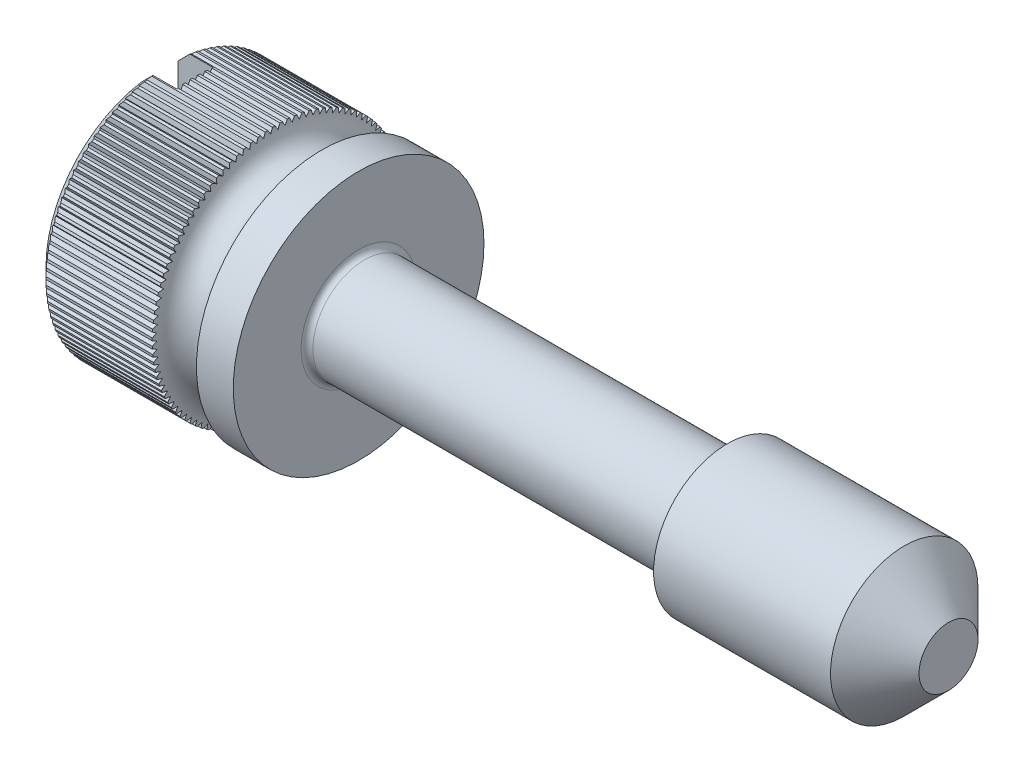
SolidWorks part; units mm, degrees
ref_plane "Front" through (0, 0, 0) normal (0, 0, 1) x (1, 0, 0)
ref_plane "Top" through (0, 0, 0) normal (0, 1, 0) x (1, 0, 0)
ref_plane "Right" through (0, 0, 0) normal (1, 0, 0) x (0, 0, -1)
sketch "Sketch1" plane through (0, 0, 0) normal (1, 0, 0) x (0, 0, -1)
  circle A0 centre (0, 0) radius 8.5
  dimension "dk" = 17
extrude "BaseHead" add sketch "Sketch1" along normal blind 13.5
sketch "Sketch2" plane through (12.6635, 0, 1.1635) normal (0, 1, 0) x (0, 0, 1)
  line L0 (7.3365, -1.6635) -> (10.3365, -1.6635)
  line L1 (7.3365, -4.6635) -> (10.3365, -4.6635)
  line L2 (10.3365, -4.6635) -> (10.3365, -1.6635)
  line L3 (7.3365, -12.6635) -> (7.3365, 0.8365) construction
  line L4 (7.3365, 0.8365) -> (-9.6635, 0.8365) construction
  line L5 (-1.1635, 4.9919) -> (-1.1635, -18.8189) construction
  arc A0 (7.3365, -1.6635) -> (7.3365, -4.6635) centre (7.3365, -3.1635) ccw
  dimension "db" = 3
  dimension "h" = 2.5
  dimension "D3" = 3
revolve "Cut-Revolve1" cut sketch "Sketch2" angle 360 about L5
chamfer "Chamfer1" distance 0.8 angle 45 1 edges at (0, 0, -8.5)
sketch "Sketch3" plane through (0, 0, 0) normal (1, 0, 0) x (0, 0, -1)
  line L1 (0, 8.2113) -> (0.25, 8.6443)
  line L2 (0.25, 8.6443) -> (-0.25, 8.6443)
  line L3 (-0.25, 8.6443) -> (0, 8.2113)
  circle A0 centre (0, 8.5) radius 0.1443 construction
  circle A2 centre (0, 0) radius 8.5 construction
  dimension "D1" = 0.5
extrude "Cut-Extrude1" cut sketch "Sketch3" along normal up to next
pattern_circular "CircularPattern1" count 107 over 360 about axis through (0, 0, 0) along (1, 0, 0) of "Cut-Extrude1"
sketch "Sketch4" plane through (13.5, 4.4852, -2.1504) normal (1, 0, 0) x (0, 0, -1)
  circle A0 centre (-2.1504, -4.4852) radius 3.5
  circle A1 centre (-2.1504, -4.4852) radius 8.5 construction
  dimension "d1" = 7
extrude "BaseBody" add sketch "Sketch4" along normal blind 40
sketch "Sketch5" plane through (53.5, -0.8575, -1.49) normal (1, 0, 0) x (0, 0, -1)
  circle A0 centre (-1.49, 0.8575) radius 5
  circle A1 centre (-1.49, 0.8575) radius 3.5 construction
  dimension "d" = 10
extrude "BaseEnd" add sketch "Sketch5" against normal blind 15
chamfer "Chamfer2" distance 3 angle 45 1 edges at (53.5, 0, -5)
fillet "Fillet1" radius 0.4 2 edges at (38.5, 0, -3.5) (13.5, 0, -3.5)
sketch "Sketch6" plane through (-10.163, 0, -10.163) normal (0, 1, 0) x (0, 0, 1)
  line L0 (2.463, 10.163) -> (17.863, 10.163) construction
  line L1 (8.913, 12.563) -> (11.413, 12.563)
  line L2 (8.913, 12.563) -> (8.913, 5.163)
  line L3 (8.913, 5.163) -> (11.413, 5.163)
  line L4 (11.413, 12.563) -> (11.413, 5.163)
  line L5 (10.163, 42.947) -> (10.163, -22.621) construction
  dimension "n" = 2.5
  dimension "t" = 2.4
  dimension "D3" = 5
extrude "Cut-Extrude2" cut sketch "Sketch6" against normal through all and the other way through all
sketch "Sketch7" plane through (0, 0, 0) normal (0, 0, 1) x (1, 0, 0)
  line L0 (38.5, 3.9175) -> (39.125, 5)
  line L1 (39.125, 5) -> (39.125, 6.25)
  line L2 (39.125, 6.25) -> (37.875, 6.25)
  line L3 (37.875, 6.25) -> (37.875, 5)
  line L4 (37.875, 5) -> (38.5, 3.9175)
  line L5 (38.5, 5) -> (38.5, -5) construction
  line L6 (0, 0) -> (41.5302, 0) construction
  dimension "D1" = 10
  dimension "D2" = 1.25
revolve "Cut-Revolve10" [suppressed] cut sketch "Sketch7" angle 360 about L6
pattern_linear "LPattern10" [suppressed] count 10 spacing 1.5 along (1, 0, 0)
equation "\"D1@CircularPattern1\" =  int( \"dk@Sketch1\" * PI / 0.5 + 1  ) "
equation "\"D1@Sketch7\" = \"d@Sketch5\""
equation "\"D2@Sketch7\" =  ( \"d@Sketch5\" - \"THD_MINOR@ThreadCosmetic1\" )  / 2"
equation "\"D3@LPattern10\" = \"D2@Sketch7\" * 1.2"
equation "\"D1@LPattern10\" = \"b@BaseEnd\" / \"D3@LPattern10\""
